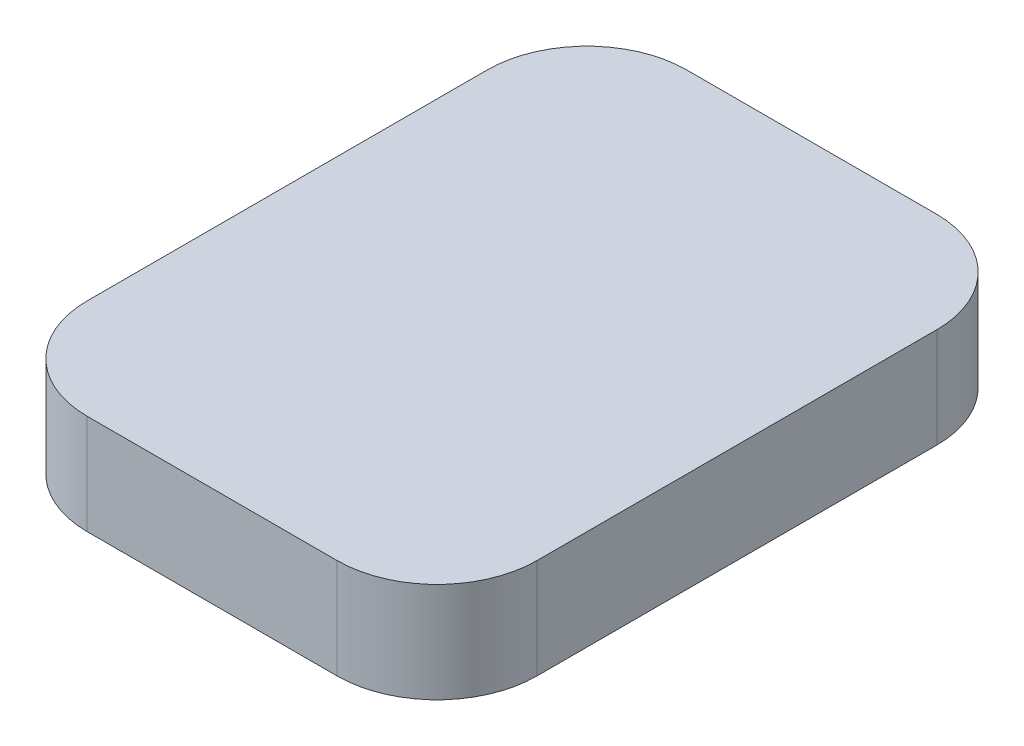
SolidWorks part; units mm, degrees
ref_plane "前视基准面" through (0, 0, 0) normal (0, 0, 1) x (1, 0, 0)
ref_plane "上视基准面" through (0, 0, 0) normal (0, 1, 0) x (1, 0, 0)
ref_plane "右视基准面" through (0, 0, 0) normal (1, 0, 0) x (0, 0, -1)
other "Configuration Table"
sketch "草图1" plane through (0, 0, 0) normal (0, 1, 0) x (1, 0, 0)
  line L5 (-11.5172, 0.0801) -> (-16.5172, 0.0801)
  line L6 (-9.5172, 2.0801) -> (-9.5172, 10.0801)
  line L7 (-11.5172, 12.0801) -> (-16.5172, 12.0801)
  line L8 (-18.5172, 2.0801) -> (-18.5172, 10.0801)
  arc A4 (-18.5172, 10.0801) -> (-16.5172, 12.0801) centre (-16.5172, 10.0801) cw
  arc A5 (-11.5172, 12.0801) -> (-9.5172, 10.0801) centre (-11.5172, 10.0801) cw
  arc A6 (-11.5172, 0.0801) -> (-9.5172, 2.0801) centre (-11.5172, 2.0801) ccw
  arc A7 (-18.5172, 2.0801) -> (-16.5172, 0.0801) centre (-16.5172, 2.0801) ccw
  point P6 (-18.5172, 12.0801)
  point P9 (-9.5172, 12.0801)
  point P14 (-18.5172, 0.0801)
  dimension "D3" = 2
  dimension "D4" = 2
  dimension "D5" = 2
  dimension "D6" = 2
  dimension "D1" = 9
  dimension "D2" = 12
extrude "凸台-拉伸1" add sketch "草图1" along normal blind 2
